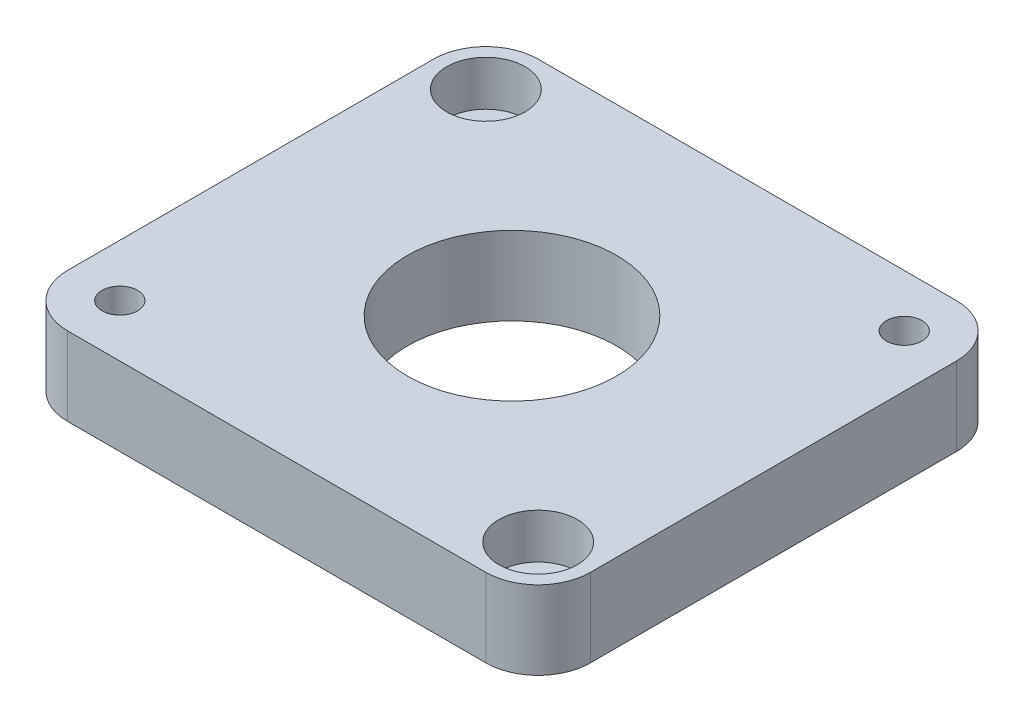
SolidWorks part; units mm, degrees
ref_plane "Ebene vorne" through (0, 0, 0) normal (0, 0, 1) x (1, 0, 0)
ref_plane "Ebene oben" through (0, 0, 0) normal (0, 1, 0) x (1, 0, 0)
ref_plane "Ebene rechts" through (0, 0, 0) normal (1, 0, 0) x (0, 0, -1)
sketch "Skizze1" plane through (0, 0, 0) normal (0, 1, 0) x (1, 0, 0)
  line L1 (-40, 45) -> (40, 45)
  line L2 (-50, 35) -> (-50, -35)
  line L3 (-40, -45) -> (40, -45)
  line L4 (50, 35) -> (50, -35)
  line L5 (-50, 45) -> (50, -45) construction
  line L6 (-50, -45) -> (50, 45) construction
  arc A0 (-40, 45) -> (-50, 35) centre (-40, 35) ccw
  arc A1 (40, 45) -> (50, 35) centre (40, 35) cw
  arc A2 (40, -45) -> (50, -35) centre (40, -35) ccw
  arc A3 (-50, -35) -> (-40, -45) centre (-40, -35) ccw
  point P0 (0, 0)
  dimension "D3" = 10
  dimension "D1" = 100
  dimension "D2" = 90
extrude "Aufsatz-Linear austragen1" add sketch "Skizze1" along normal blind 15
sketch "Skizze2" plane through (0, 15, 0) normal (0, 1, 0) x (1, 0, 0)
  circle A0 centre (0, 0) radius 20
  dimension "D1" = 40
extrude "Schnitt-Linear austragen1" cut sketch "Skizze2" against normal through all
hole_wizard "Stirnsenkung für M8 Zylinderschraube mit Innensechskant1" positions "3D-Skizze1" profile "Skizze3" counterbore size "M8" standard "DIN"
sketch3d "3D-Skizze1"
  line L0 (-40, 15, -35) -> (-40, 0, -35) construction
  line L1 (40, 15, 35) -> (40, 0, 35) construction
  point P0 (-40, 15, -35)
  point P4 (40, 15, 35)
sketch "Skizze3" plane through (-40, 15, -35) normal (1, 0, 0) x (0, 0, 1)
  line L0 (0, 0) -> (0, 15)
  line L1 (0, 15) -> (4.5, 15)
  line L3 (4.5, 15) -> (4.5, 8.6)
  line L4 (4.5, 8.6) -> (7.5, 8.6)
  line L5 (7.5, 8.6) -> (7.5, 0)
  line L7 (7.5, 0) -> (0, 0)
  line L11 (0, -6.35) -> (0, 107.95) construction
  dimension "Bohrerdurchmesser" = 9
  dimension "Bohrungstiefe" = 15
  dimension "Senkdurchmesser2" = 15
  dimension "Senktiefe2" = 8.6
hole_wizard "M8 Gewindebohrung1" positions "3D-Skizze2" profile "Skizze4" tap size "M8" standard "DIN"
sketch3d "3D-Skizze2"
  line L0 (40, 15, -35) -> (40, 0, -35) construction
  line L1 (-40, 15, 35) -> (-40, 0, 35) construction
  point P0 (40, 15, -35)
  point P4 (-40, 15, 35)
sketch "Skizze4" plane through (40, 15, -35) normal (1, 0, 0) x (0, 0, 1)
  line L0 (0, 0) -> (0, 15)
  line L1 (0, 15) -> (3.4, 15)
  line L2 (3.4, 15) -> (3.4, 0)
  line L5 (3.4, 0) -> (0, 0)
  line L11 (0, -6.35) -> (0, 107.95) construction
  dimension "Bohrerdurchmesser" = 6.8
  dimension "Bohrungstiefe" = 15
